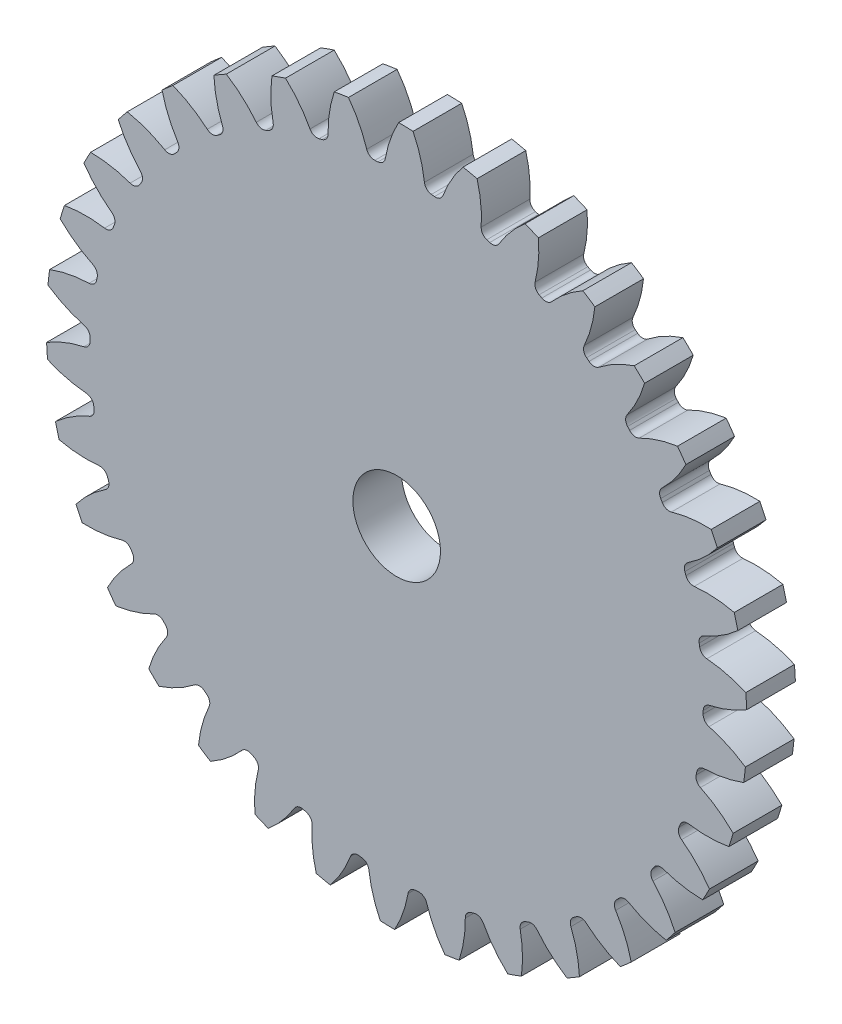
SolidWorks part; units mm, degrees
ref_plane "Front" through (0, 0, 0) normal (0, 0, 1) x (1, 0, 0)
ref_plane "Top" through (0, 0, 0) normal (0, 1, 0) x (1, 0, 0)
ref_plane "Right" through (0, 0, 0) normal (1, 0, 0) x (0, 0, -1)
sketch "Sketch3" plane through (0, 0, 0) normal (0, 0, 1) x (1, 0, 0)
  circle A0 centre (0, 0) radius 914.4
  dimension "od" = 1828.8
extrude "gearBody" add sketch "Sketch3" along normal blind 127
sketch "Sketch2" plane through (0, 0, 0) normal (0, 0, 1) x (1, 0, 0)
  line L0 (0, 0) -> (749.7454, 310.5547) construction
  line L1 (910.9225, -90.1783) -> (0, 0) construction
  line L2 (0, 0) -> (36.3143, 0) construction
  line L3 (863.4328, 16.995) -> (861.3507, -62.2897) construction
  line L5 (862.3917, -22.6473) -> (0, 0) construction
  line L7 (0, 0) -> (811.5185, 0) construction
  arc A0 (811.5164, 1.8697) -> (810.2997, -44.4603) centre (0, 0) ccw construction
  arc A1 (913.4504, 41.6629) -> (910.0046, -89.5488) centre (0, 0) ccw construction
  arc A2 (863.4328, 16.995) -> (861.3507, -62.2897) centre (0, 0) ccw construction
  arc A3 (799.7067, -25.0855) -> (799.921, -16.9225) centre (0, 0) ccw
  arc A4 (910.9225, -90.1783) -> (814.9511, -45.686) centre (732.4122, -349.4778) ccw
  arc A5 (910.9225, -90.1783) -> (914.4, 42.2434) centre (0, 0) ccw
  arc A6 (914.4, 42.2434) -> (816.2257, 2.8495) centre (749.7454, 310.5547) cw
  arc A7 (799.921, -16.9225) -> (816.2257, 2.8495) centre (820.592, -17.3598) cw
  arc A8 (814.9511, -45.686) -> (799.7067, -25.0855) centre (820.3721, -25.7337) cw
  point P6 (914.4, 42.2434)
  point P22 (910.9225, -90.1783)
  dimension "baseDia" = 1623.0371
  dimension "od" = 1828.8
  dimension "pd" = 1727.2
  dimension "rd" = 1600.2
  dimension "rFillet" = 20.6756
  dimension "pointX" = 914.4
  dimension "pointY" = 42.2434
  dimension "CTT" = 79.2847
  dimension "flankCenterAngle" = 22.5
extrude "toothCut" cut sketch "Sketch2" along normal through all
pattern_circular "CirPattern1" count 34 over 360 about axis through (0, 0, 0) along (0, 0, 1) of "toothCut"
sketch "hub1Dia" plane through (0, 0, 0) normal (0, 0, -1) x (-1, 0, 0)
  circle A0 centre (0, 0) radius 12.7
  dimension "hub1Dia" = 25.4
sketch "hub2Dia" plane through (0, 0, 127) normal (0, 0, 1) x (1, 0, 0)
  circle A0 centre (0, 0) radius 12.7
  dimension "hub2dia" = 25.4
sketch "boreDia" plane through (0, 0, 0) normal (0, 0, 1) x (1, 0, 0)
  circle A0 centre (0, 0) radius 114.3
  dimension "boreDia" = 228.6
extrude "bore" cut sketch "boreDia" against normal mid plane 25400
